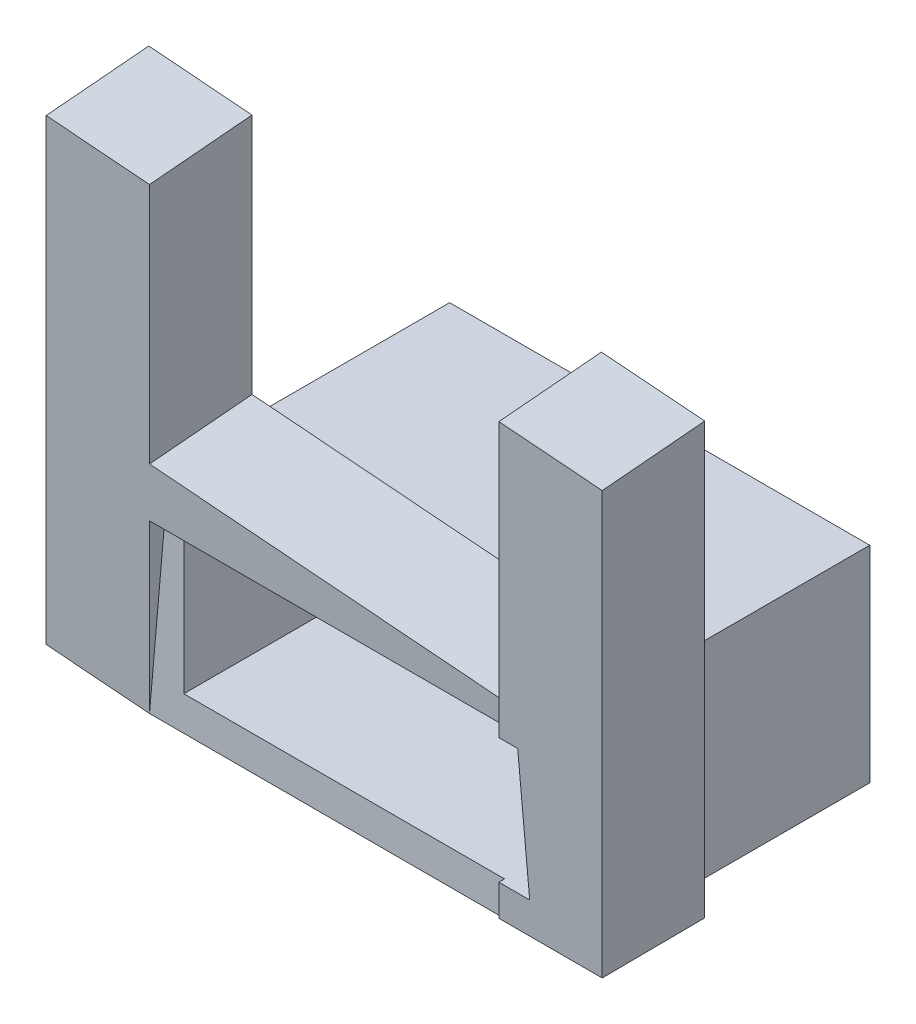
SolidWorks part; units mm, degrees
ref_plane "Front Plane" through (0, 0, 0) normal (0, 0, 1) x (1, 0, 0)
ref_plane "Top Plane" through (0, 0, 0) normal (0, 1, 0) x (1, 0, 0)
ref_plane "Right Plane" through (0, 0, 0) normal (1, 0, 0) x (0, 0, -1)
sketch "Sketch1" plane through (0, 0, 0) normal (0, 0, 1) x (1, 0, 0)
  line L0 (0, 0) -> (40.844, -3.5734)
sketch "Sketch3" plane through (0, 0, 0) normal (1, 0, 0) x (0, 0, -1)
  line L0 (0, 0) -> (34.8668, 3.0505)
ref_plane "Plane5" through (0, 0, 0) normal (0.0868, 0.9924, 0.0868) x (0.9962, -0.0865, -0.0076)
sketch "Sketch4" plane through (0, 0, 0) normal (0.0868, 0.9924, 0.0868) x (0.9962, -0.0865, -0.0076)
  line L0 (0, 0) -> (0, 12)
  line L1 (0, 0) -> (0, 35) construction
  line L2 (0, 12) -> (-12, 12)
  line L3 (-12, 12) -> (-12, 0)
  line L4 (-12, 0) -> (0, 0)
  line L5 (40.9067, -0.3107) -> (40.9067, 11.6893)
  line L6 (0, 0) -> (40.9988, -0.3114) construction
  line L7 (40.9067, 11.6893) -> (52.9067, 11.6893)
  line L8 (52.9067, 11.6893) -> (52.9067, -0.3107)
  line L9 (52.9067, -0.3107) -> (40.9067, -0.3107)
  point P13 (0, 0)
extrude "Boss-Extrude1" add sketch "Sketch4" along normal blind 59
sketch "attatch slide" plane through (0, 0, 0) normal (0, 0, 1) x (1, 0, 0)
  line L0 (4, 4) -> (4, 20)
  line L1 (0, 0) -> (49, 0)
  line L2 (0, 0) -> (0, 24)
  line L3 (0, 24) -> (49, 24)
  line L4 (49, 0) -> (49, 24)
  line L5 (4, 20) -> (45, 20)
  line L6 (45, 4) -> (45, 20)
  line L7 (4, 4) -> (45, 4)
extrude "Boss-Extrude2" add sketch "attatch slide" against normal blind 35 separate body contours L5 L6 L7 L0 | L3 L4 L1 L2
ref_plane "Plane6" through (0, 0, -35) normal (0, 0, -1) x (-1, 0, 0)
sketch "Sketch8" plane through (0, 0, -35) normal (0, 0, -1) x (-1, 0, 0)
  line L0 (-4, 4) -> (-4, 20) construction
  line L1 (-45, 20) -> (-4, 20)
  line L2 (-45, 20) -> (-45, 4)
  line L3 (-45, 4) -> (-4, 4)
  line L4 (-4, 20) -> (-4, 4)
  line L5 (-4, 4) -> (-45, 4) construction
  line L7 (0, 0) -> (-58.8688, 0)
  line L8 (0, 0) -> (0, -8.0719)
  line L9 (0, -8.0719) -> (-58.8688, -8.0719)
  line L10 (-58.8688, 0) -> (-58.8688, -8.0719)
  point P14 (0, 0)
  point P15 (0, 0)
extrude "Cut-Extrude1" cut sketch "Sketch8" against normal through all contours L1 L4 L3 L2
sketch "Sketch9" plane through (0, 0, -35) normal (0, 0, -1) x (-1, 0, 0)
  line L1 (0, 0) -> (-64.3846, 0)
  line L2 (0, 0) -> (0, -9.2538)
  line L3 (0, -9.2538) -> (-64.3846, -9.2538)
  line L4 (-64.3846, 0) -> (-64.3846, -9.2538)
extrude "Cut-Extrude2" cut sketch "Sketch9" against normal through all
ref_plane "Plane7" through (0, 0, 0) normal (0, -0.0872, 0.9962) x (1, 0, 0)
sketch "Sketch11" plane through (0, 0, 0) normal (0, -0.0872, 0.9962) x (1, 0, 0)
  line L0 (-1.8574, 21.4114) -> (44.3444, 21.4114)
  line L1 (44.3444, 21.4114) -> (43.0456, 24.1715)
  line L2 (43.0456, 24.1715) -> (-1.8574, 28.1)
  line L3 (-1.8574, 28.1) -> (-1.8574, 21.4114)
  point P2 (0, 0)
  point P5 (-1.8574, 21.4114)
  point P6 (0, 0)
  point P7 (0, 0)
  point P8 (44.3444, 21.4114)
extrude "Boss-Extrude3" add sketch "Sketch11" against normal blind 12
